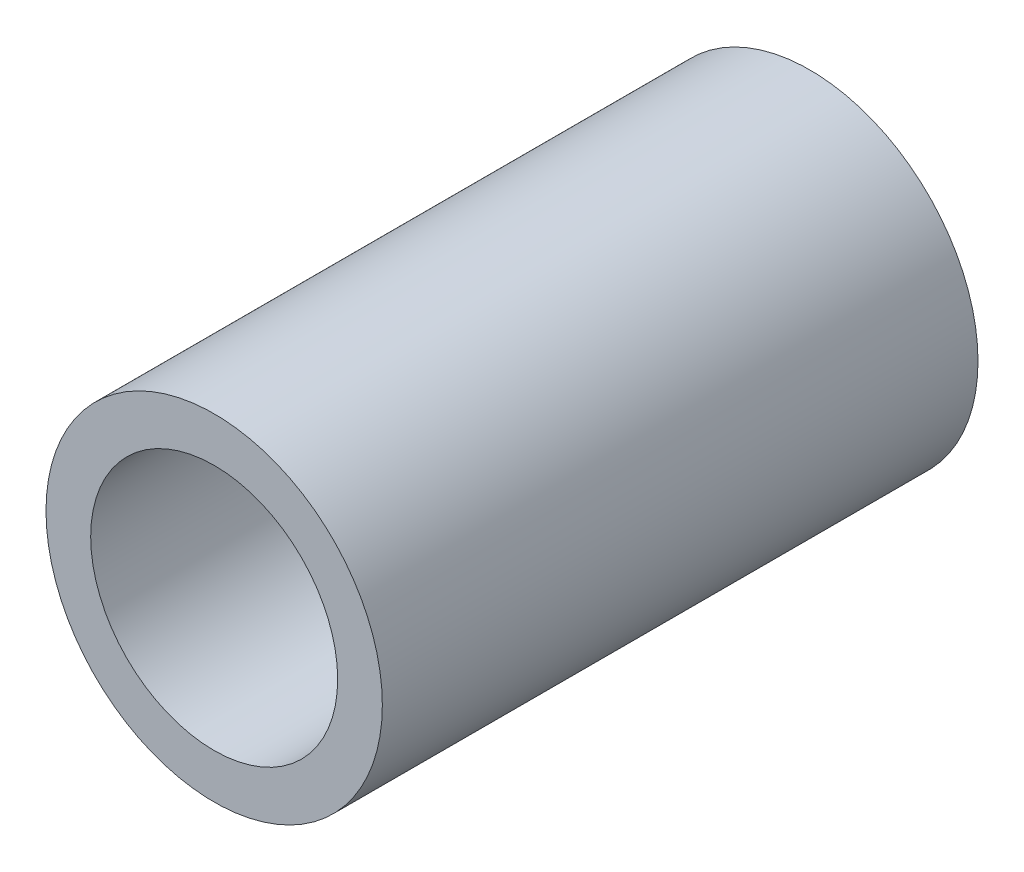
SolidWorks part; units mm, degrees
ref_plane "Front" through (0, 0, 0) normal (0, 0, 1) x (1, 0, 0)
ref_plane "Top" through (0, 0, 0) normal (0, 1, 0) x (1, 0, 0)
ref_plane "Right" through (0, 0, 0) normal (1, 0, 0) x (0, 0, -1)
sketch "Sketch1" plane through (0, 0, 0) normal (0, 0, 1) x (1, 0, 0)
  circle A0 centre (0, 0) radius 10.7569
  circle A1 centre (0, 0) radius 7.8994
  dimension "D1" = 21.5138
  dimension "D2" = 15.7988
extrude "Boss-Extrude1" add sketch "Sketch1" along normal mid plane 38.1
